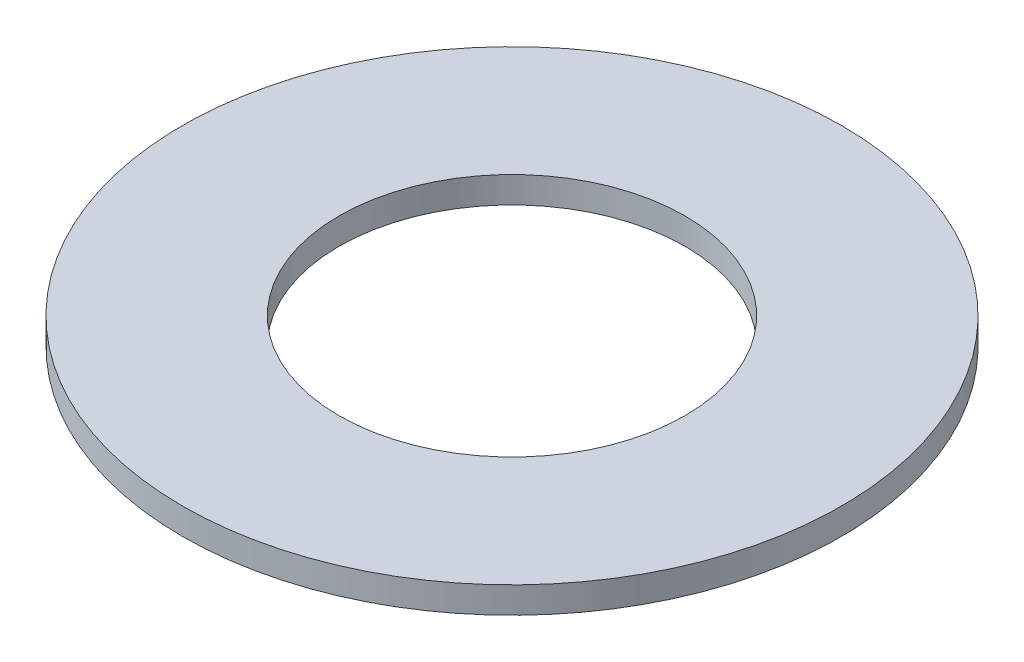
SolidWorks part; units mm, degrees
ref_plane "Płaszczyzna przednia" through (0, 0, 0) normal (0, 0, 1) x (1, 0, 0)
ref_plane "Płaszczyzna górna" through (0, 0, 0) normal (0, 1, 0) x (1, 0, 0)
ref_plane "Płaszczyzna prawa" through (0, 0, 0) normal (1, 0, 0) x (0, 0, -1)
sketch "Szkic1" plane through (0, 0, 0) normal (0, 1, 0) x (1, 0, 0)
  circle A0 centre (0, 0) radius 5.25
  circle A1 centre (0, 0) radius 10
  dimension "D1" = 20
  dimension "D2" = 10.5
extrude "Dodanie-wyciągnięcie1" add sketch "Szkic1" along normal blind 0.8
